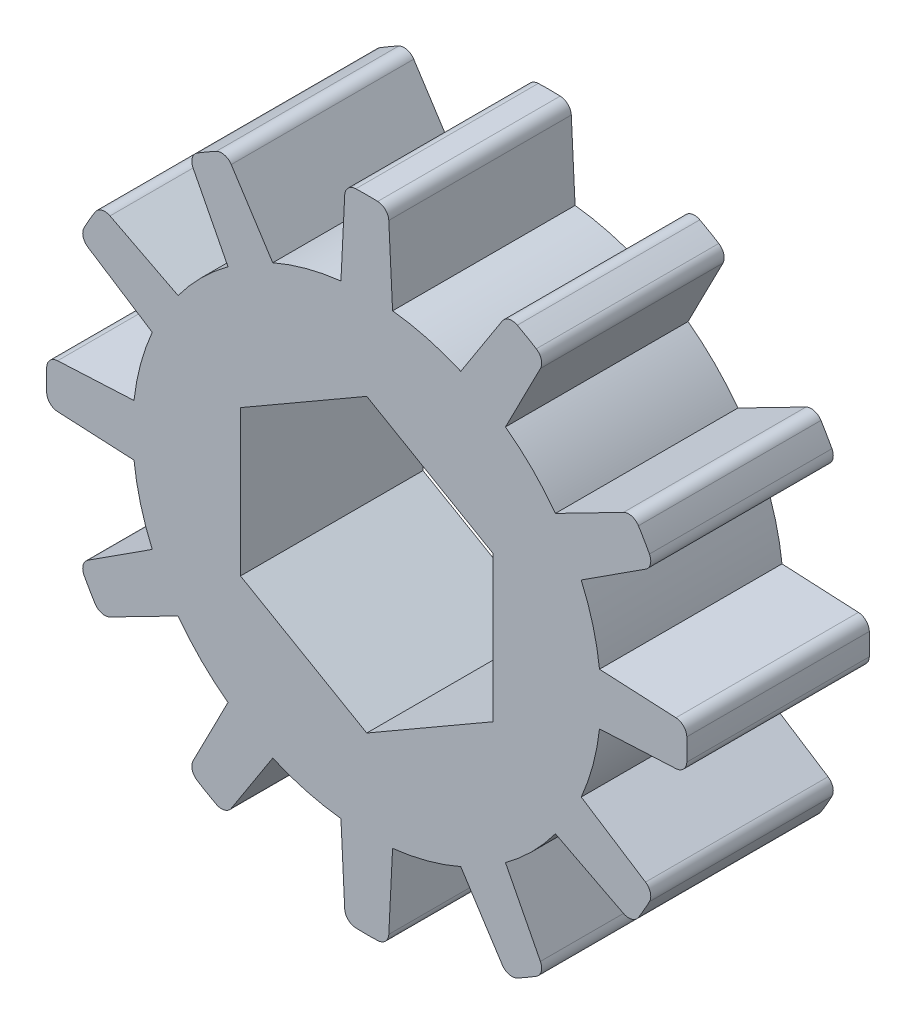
SolidWorks part; units mm, degrees
ref_plane "Alzado" through (0, 0, 0) normal (0, 0, 1) x (1, 0, 0)
ref_plane "Planta" through (0, 0, 0) normal (0, 1, 0) x (1, 0, 0)
ref_plane "Vista lateral" through (0, 0, 0) normal (1, 0, 0) x (0, 0, -1)
sketch "Croquis1" plane through (0, 0, 0) normal (0, 0, 1) x (1, 0, 0)
  line L0 (0, 0) -> (0, 4.6049) construction
  line L1 (0.375, 5.5679) -> (0.45, 4.0556)
  line L2 (-0.375, 5.5679) -> (-0.45, 4.0556)
  line L3 (2.4592, 5.0094) -> (1.6381, 3.7373)
  line L4 (3.1087, 4.6344) -> (2.4175, 3.2873)
  line L5 (4.6344, 3.1087) -> (3.2873, 2.4175)
  line L6 (5.0094, 2.4592) -> (3.7373, 1.6381)
  line L7 (5.5679, 0.375) -> (4.0556, 0.45)
  line L8 (5.5679, -0.375) -> (4.0556, -0.45)
  line L9 (5.0094, -2.4592) -> (3.7373, -1.6381)
  line L10 (4.6344, -3.1087) -> (3.2873, -2.4175)
  line L11 (3.1087, -4.6344) -> (2.4175, -3.2873)
  line L12 (2.4592, -5.0094) -> (1.6381, -3.7373)
  line L13 (0.375, -5.5679) -> (0.45, -4.0556)
  line L14 (-0.375, -5.5679) -> (-0.45, -4.0556)
  line L15 (-2.4592, -5.0094) -> (-1.6381, -3.7373)
  line L16 (-3.1087, -4.6344) -> (-2.4175, -3.2873)
  line L17 (-4.6344, -3.1087) -> (-3.2873, -2.4175)
  line L18 (-5.0094, -2.4592) -> (-3.7373, -1.6381)
  line L19 (-5.5679, -0.375) -> (-4.0556, -0.45)
  line L20 (-5.5679, 0.375) -> (-4.0556, 0.45)
  line L21 (-5.0094, 2.4592) -> (-3.7373, 1.6381)
  line L22 (-4.6344, 3.1087) -> (-3.2873, 2.4175)
  line L23 (-3.1087, 4.6344) -> (-2.4175, 3.2873)
  line L24 (-2.4592, 5.0094) -> (-1.6381, 3.7373)
  circle A0 centre (0, 0) radius 0.5
  arc A1 (1.6381, 3.7373) -> (0.45, 4.0556) centre (0, 0) ccw
  arc A2 (3.1087, 4.6344) -> (2.4592, 5.0094) centre (0, 0) ccw
  arc A3 (5.0094, 2.4592) -> (4.6344, 3.1087) centre (0, 0) ccw
  arc A4 (5.5679, -0.375) -> (5.5679, 0.375) centre (0, 0) ccw
  arc A5 (4.6344, -3.1087) -> (5.0094, -2.4592) centre (0, 0) ccw
  arc A6 (2.4592, -5.0094) -> (3.1087, -4.6344) centre (0, 0) ccw
  arc A7 (-0.375, -5.5679) -> (0.375, -5.5679) centre (0, 0) ccw
  arc A8 (-3.1087, -4.6344) -> (-2.4592, -5.0094) centre (0, 0) ccw
  arc A9 (-5.0094, -2.4592) -> (-4.6344, -3.1087) centre (0, 0) ccw
  arc A10 (-5.5679, 0.375) -> (-5.5679, -0.375) centre (0, 0) ccw
  arc A11 (-4.6344, 3.1087) -> (-5.0094, 2.4592) centre (0, 0) ccw
  arc A12 (-2.4592, 5.0094) -> (-3.1087, 4.6344) centre (0, 0) ccw
  arc A13 (0.375, 5.5679) -> (-0.375, 5.5679) centre (0, 0) ccw
  arc A14 (3.2873, 2.4175) -> (2.4175, 3.2873) centre (0, 0) ccw
  arc A15 (4.0556, 0.45) -> (3.7373, 1.6381) centre (0, 0) ccw
  arc A16 (3.7373, -1.6381) -> (4.0556, -0.45) centre (0, 0) ccw
  arc A17 (2.4175, -3.2873) -> (3.2873, -2.4175) centre (0, 0) ccw
  arc A18 (0.45, -4.0556) -> (1.6381, -3.7373) centre (0, 0) ccw
  arc A19 (-1.6381, -3.7373) -> (-0.45, -4.0556) centre (0, 0) ccw
  arc A20 (-3.2873, -2.4175) -> (-2.4175, -3.2873) centre (0, 0) ccw
  arc A21 (-4.0556, -0.45) -> (-3.7373, -1.6381) centre (0, 0) ccw
  arc A22 (-3.7373, 1.6381) -> (-4.0556, 0.45) centre (0, 0) ccw
  arc A23 (-2.4175, 3.2873) -> (-3.2873, 2.4175) centre (0, 0) ccw
  arc A24 (-0.45, 4.0556) -> (-1.6381, 3.7373) centre (0, 0) ccw
  dimension "D1" = 0.9
  dimension "D2" = 1
  dimension "D4" = 1.5
  dimension "D3" = 0.75
  dimension "D6" = 1.23
  dimension "D5" = 12
extrude "Saliente-Extruir1" add sketch "Croquis1" along normal blind 3.18
sketch "Croquis10" plane through (0, 0, 0) normal (0, 0, -1) x (-1, 0, 0)
  line L1 (0, -2.5403) -> (2.2, -1.2702)
  line L2 (2.2, -1.2702) -> (2.2, 1.2702)
  line L3 (2.2, 1.2702) -> (0, 2.5403)
  line L4 (0, 2.5403) -> (-2.2, 1.2702)
  line L5 (-2.2, 1.2702) -> (-2.2, -1.2702)
  line L6 (-2.2, -1.2702) -> (0, -2.5403)
  circle A0 centre (0, 0) radius 2.2 construction
  dimension "D1" = 4.4
extrude "Cortar-Extruir3" cut sketch "Croquis10" against normal through all
fillet "Redondeo1" radius 0.2 24 edges at (5.5679, -0.375, 1.59) (-2.4592, -5.0094, 1.59) (-3.1087, -4.6344, 1.59) (0.375, -5.5679, 1.59) (-0.375, -5.5679, 1.59) (3.1087, -4.6344, 1.59) (2.4592, -5.0094, 1.59) (5.0094, -2.4592, 1.59) (4.6344, -3.1087, 1.59) (-4.6344, -3.1087, 1.59) (-5.0094, -2.4592, 1.59) (-5.5679, -0.375, 1.59) (-5.5679, 0.375, 1.59) (-5.0094, 2.4592, 1.59) (-4.6344, 3.1087, 1.59) (-3.1087, 4.6344, 1.59) (-2.4592, 5.0094, 1.59) (5.5679, 0.375, 1.59) (5.0094, 2.4592, 1.59) (4.6344, 3.1087, 1.59) (3.1087, 4.6344, 1.59) (2.4592, 5.0094, 1.59) (0.375, 5.5679, 1.59) (-0.375, 5.5679, 1.59)
